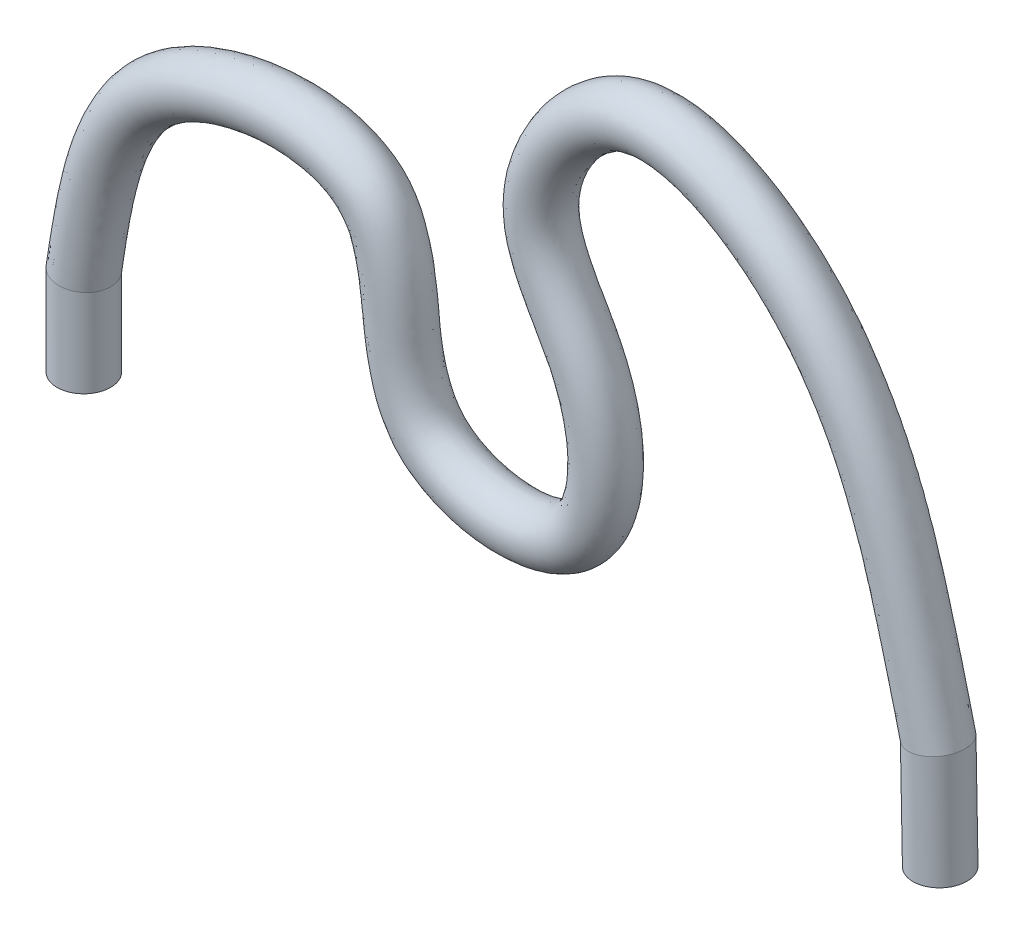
SolidWorks part; units mm, degrees
ref_plane "Front" through (0, 0, 0) normal (0, 0, 1) x (1, 0, 0)
ref_plane "Top" through (0, 0, 0) normal (0, 1, 0) x (1, 0, 0)
ref_plane "Right" through (0, 0, 0) normal (1, 0, 0) x (0, 0, -1)
sketch "Sketch1" plane through (0, 0, 0) normal (0, 1, 0) x (1, 0, 0)
  circle A0 centre (0, 0) radius 1.5
sketch3d "3DSketch2"
  line L0 (0, 0, 0) -> (0, 5, 0)
  line L2 (47.8855, 6.2015, 0) -> (48, 0, 0)
  spline S0 degree 3 poles (0, 5, 0) (0.7108, 9.5591, 0) (2.0496, 18.1469, 0) (19.6712, 19.5707, 0) (16.0974, 5.29, 0) (29.3686, 3.8233, 0) (29.7451, 14.284, 0) (23.5374, 20.3403, 0) (30.41, 30.7512, 0) (42.1231, 24.0396, 0) (45.753, 14.8049, 0) (47.3132, 8.5102, 0) (47.8855, 6.2015, 0) knots 0 0 0 0 0.131495 0.24769 0.355205 0.439221 0.519374 0.601322 0.687094 0.798505 0.926097 1 1 1 1
sweep "Sweep8" add profiles "Sketch1" path "3DSketch2"
